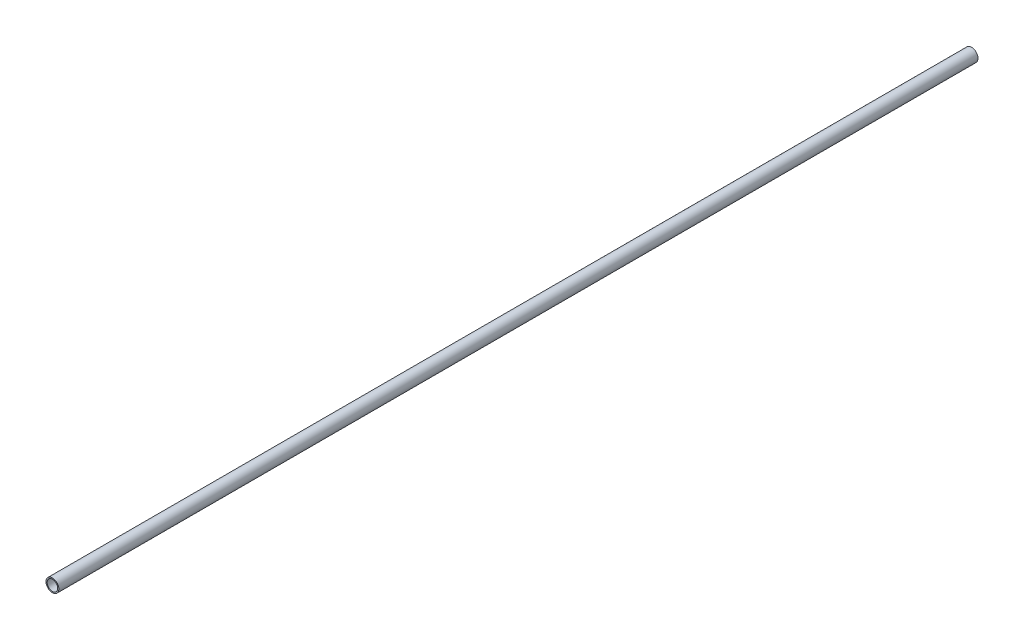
SolidWorks part; units mm, degrees
ref_plane "Face" through (0, 0, 0) normal (0, 0, 1) x (1, 0, 0)
ref_plane "Dessus" through (0, 0, 0) normal (0, 1, 0) x (1, 0, 0)
ref_plane "Droite" through (0, 0, 0) normal (1, 0, 0) x (0, 0, -1)
sketch "Esquisse1" plane through (0, 0, 0) normal (0, 0, 1) x (1, 0, 0)
  circle A0 centre (0, 0) radius 4.9
  circle A1 centre (0, 0) radius 4
  dimension "D1" = 9.8
  dimension "D2" = 8
extrude "Extrusion1" add sketch "Esquisse1" along normal blind 700
